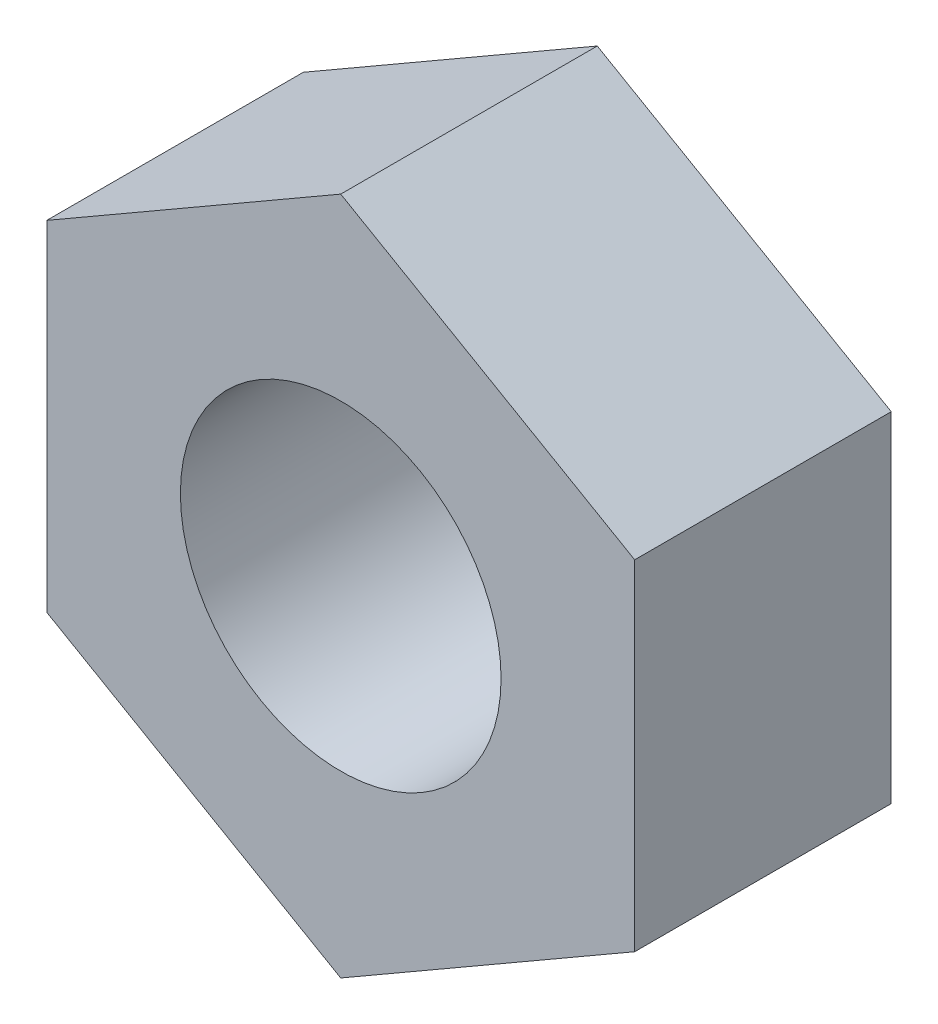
SolidWorks part; units mm, degrees
ref_plane "前视基准面" through (0, 0, 0) normal (0, 0, 1) x (1, 0, 0)
ref_plane "上视基准面" through (0, 0, 0) normal (0, 1, 0) x (1, 0, 0)
ref_plane "右视基准面" through (0, 0, 0) normal (1, 0, 0) x (0, 0, -1)
other "Configuration Table"
sketch "草图1" plane through (0, 0, 0) normal (0, 0, 1) x (1, 0, 0)
  line L0 (2.75, 1.5877) -> (0, 3.1754)
  line L1 (0, 3.1754) -> (-2.75, 1.5877)
  line L2 (-2.75, 1.5877) -> (-2.75, -1.5877)
  line L3 (-2.75, -1.5877) -> (0, -3.1754)
  line L4 (0, -3.1754) -> (2.75, -1.5877)
  line L5 (2.75, -1.5877) -> (2.75, 1.5877)
  circle A0 centre (0, 0) radius 1.5
  dimension "D1" = 3
  dimension "D2" = 2.75
  dimension "D3" = 1.5877
  dimension "D4" = 3.1754
extrude "Unthreaded_nominal_nut" add sketch "草图1" along normal blind 2.4
